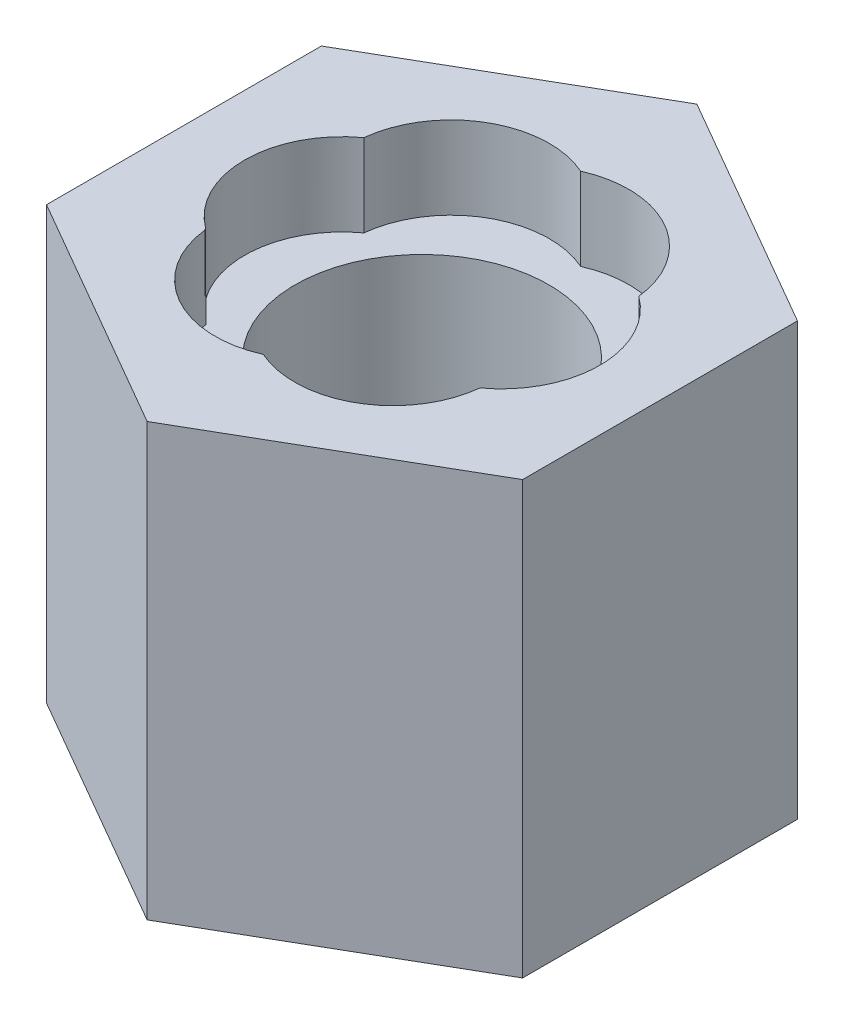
SolidWorks part; units mm, degrees
ref_plane "Front Plane" through (0, 0, 0) normal (0, 0, 1) x (1, 0, 0)
ref_plane "Top Plane" through (0, 0, 0) normal (0, 1, 0) x (1, 0, 0)
ref_plane "Right Plane" through (0, 0, 0) normal (1, 0, 0) x (0, 0, -1)
sketch "Sketch1" plane through (0, 0, 0) normal (0, 1, 0) x (1, 0, 0)
  line L0 (31.25, 32.475) -> (45.4247, 32.475)
  line L1 (75, 32.475) -> (75, 52.45)
  line L2 (75, 97.425) -> (68.75, 97.425)
  line L4 (0, 97.425) -> (0, 77.45)
  line L5 (0, 32.475) -> (6.25, 32.475)
  line L6 (56.25, 54.1247) -> (56.25, 75.7753)
  line L7 (18.75, 54.1247) -> (18.75, 75.7753)
  line L8 (0, 52.45) -> (0, 32.475)
  line L9 (18.75, 54.1247) -> (37.5, 43.2994)
  line L10 (37.5, 43.2994) -> (56.25, 54.1247)
  line L11 (56.25, 54.1247) -> (56.25, 75.7753)
  line L12 (56.25, 75.7753) -> (37.5, 86.6006)
  line L13 (37.5, 86.6006) -> (18.75, 75.7753)
  line L14 (18.75, 75.7753) -> (18.75, 54.1247)
  line L15 (68.75, 32.475) -> (75, 32.475)
  line L16 (75, 77.45) -> (75, 97.425)
  line L17 (43.75, 97.425) -> (31.25, 97.425)
  line L18 (6.25, 97.425) -> (0, 97.425)
  line L20 (29.1713, 39.3776) -> (17.9828, 44.9514)
  line L21 (56.25, 44.975) -> (45.4247, 38.725)
  line L28 (63.7858, 70.4718) -> (64.6108, 57.9991)
  line L38 (45.4247, 91.175) -> (56.25, 84.925)
  line L39 (18.75, 84.925) -> (29.5753, 91.175)
  line L45 (7.9042, 32.475) -> (7.9247, 32.475)
  line L49 (10.8253, 58.7) -> (10.8253, 71.2)
  circle A0 centre (37.5, 64.95) radius 10
  arc A3 (0, 52.45) -> (0, 77.45) centre (0, 64.95) ccw
  circle A4 centre (37.5, 64.95) radius 12.5
  arc A5 (75, 77.45) -> (75, 52.45) centre (75, 64.95) ccw
  arc A9 (6.25, 97.425) -> (31.25, 97.425) centre (18.75, 97.425) ccw
  arc A10 (43.75, 97.425) -> (68.75, 97.425) centre (56.25, 97.425) ccw
  arc A12 (31.25, 32.475) -> (6.25, 32.475) centre (18.75, 32.475) ccw
  arc A13 (68.75, 32.475) -> (43.75, 32.475) centre (56.25, 32.475) ccw
  circle A18 centre (18.75, -32.475) radius 12.5
  circle A19 centre (56.25, -32.475) radius 12.5
  circle A20 centre (93.75, -32.475) radius 12.5
  circle A21 centre (75, 0) radius 12.5
  circle A22 centre (37.5, 0) radius 12.5
  circle A23 centre (0, 0) radius 12.5
  circle A24 centre (0, 129.9) radius 12.5
  circle A25 centre (37.5, 129.9) radius 12.5
  circle A26 centre (75, 129.9) radius 12.5
  circle A27 centre (93.75, 97.425) radius 12.5
  circle A28 centre (93.75, 32.475) radius 12.5
  dimension "D1" = 3
  dimension "D3" = 3
  dimension "D2" = 3
  dimension "D4" = 3
extrude "Boss-Extrude5" add sketch "Sketch1" along normal blind 34 contours A0 | A4 A0 | L12 L13 L7 L9 L10 L6 A4
sketch "Sketch3" plane through (0, 34, 0) normal (0, 1, 0) x (1, 0, 0)
  line L0 (18.75, 75.7753) -> (56.25, 54.1247)
  line L1 (18.75, 54.1247) -> (56.25, 75.7753)
  circle A0 centre (37.5, 64.95) radius 10
extrude "Cut-Extrude2" cut sketch "Sketch3" against normal blind 24 contours L0 A0 L1 | L1 A0 L0 | L1 A0 L0 | L0 A0 L1
sketch "Sketch4" plane through (0, 34, 0) normal (0, 1, 0) x (1, 0, 0)
  circle A0 centre (37.5, 64.95) radius 12.5
extrude "Cut-Extrude3" cut sketch "Sketch4" against normal blind 4
sketch "Sketch5" plane through (0, 10, 0) normal (0, 1, 0) x (1, 0, 0)
  line L0 (18.75, 75.7753) -> (56.25, 54.1247)
  line L1 (18.75, 54.1247) -> (56.25, 75.7753)
  circle A0 centre (37.5, 64.95) radius 9.9
  circle A1 centre (37.5, 64.95) radius 10
extrude "Cut-Extrude7" cut sketch "Sketch5" against normal blind 10 contours A1
sketch "Sketch9" plane through (0, 30, 0) normal (0, 1, 0) x (-1, 0, 0)
  circle A0 centre (-37.5, -64.95) radius 12.5
extrude "Cut-Extrude8" cut sketch "Sketch9" against normal blind 0.5
sketch "Sketch10" plane through (0, 34, 0) normal (0, 1, 0) x (-1, 0, 0)
  line L0 (-26.6747, -71.2) -> (-48.3253, -58.7)
  line L1 (-37.5, -64.95) -> (-37.5, -77.45)
  line L7 (-37.5, -77.45) -> (-37.5, -77.0744)
  line L8 (-26.7101, -58.7204) -> (-48.3253, -71.2)
  line L11 (-37.5, -64.95) -> (-37.5, -52.45)
  circle A0 centre (-37.5, -64.95) radius 12.5
  arc A1 (-26.6747, -71.2) -> (-26.7101, -58.7204) centre (-31.1945, -64.973) ccw
  arc A2 (-37.5, -77.45) -> (-48.3253, -71.2) centre (-40.6302, -70.3717) cw
  circle A3 centre (-37.5, -64.95) radius 12.5 construction
  circle A4 centre (-37.5, -64.95) radius 10
  arc A5 (-37.5, -77.45) -> (-26.6747, -71.2) centre (-34.3698, -70.3717) ccw
  arc A6 (-48.3253, -71.2) -> (-48.3253, -58.7) centre (-43.7605, -64.95) cw
  circle A7 centre (-37.5, -64.95) radius 12.5 construction
  arc A8 (-48.3253, -58.7) -> (-37.5, -52.45) centre (-40.6302, -59.5283) cw
  arc A9 (-37.5, -52.45) -> (-26.7101, -58.7204) centre (-34.3671, -59.4777) cw
extrude "Cut-Extrude9" cut sketch "Sketch10" against normal blind 6.5 contours A5 M1 | A2 M1 | A6 M1 | A8 M1 | A9 M1 | A0 A1 | A4 L0 A0 A1 L8 | A4 L1 L0 M1 | A4 L8 L1 M1 | A4 L0 L8 M1 | A4 L11 L0 M1 | A9 L11 A4 L8 M1
